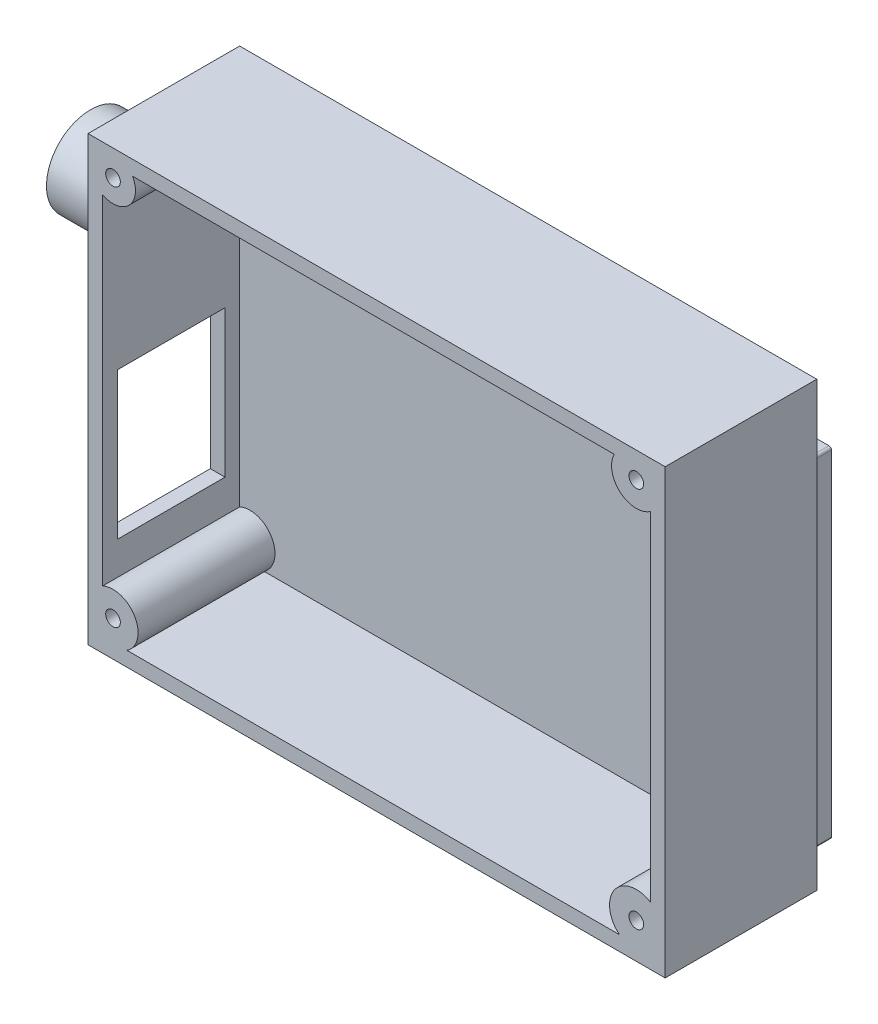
SolidWorks part; units mm, degrees
ref_plane "Plan de face" through (0, 0, 0) normal (0, 0, 1) x (1, 0, 0)
ref_plane "Plan de dessus" through (0, 0, 0) normal (0, 1, 0) x (1, 0, 0)
ref_plane "Plan de droite" through (0, 0, 0) normal (1, 0, 0) x (0, 0, -1)
imported_body "Importée1"
sketch "Esquisse2" plane through (0, 0, 0) normal (0, 0, -1) x (-1, 0, 0)
  circle A0 centre (7, 76.575) radius 2 construction
  circle A1 centre (7, 76.575) radius 2
  circle A2 centre (77.5, 76.575) radius 2 construction
  circle A3 centre (7, 11.075) radius 2 construction
  circle A4 centre (77.5, 11.075) radius 2 construction
  circle A5 centre (77.5, 76.575) radius 2
  circle A6 centre (7, 11.075) radius 2
  circle A7 centre (77.5, 11.075) radius 2
extrude "Boss.-Extru.1" add sketch "Esquisse2" against normal up to surface (7 mm away)
sketch "Esquisse4" plane through (0, 0, 0) normal (0, 0, -1) x (-1, 0, 0)
  line L0 (83, 74.575) -> (1, 74.575) construction
  line L1 (1, 82.575) -> (83.5, 82.575)
  line L2 (1, 82.575) -> (1, 74.575)
  line L3 (1, 74.575) -> (83.5, 74.575)
  line L4 (83.5, 82.575) -> (83.5, 74.575)
  line L5 (1, 7.075) -> (1, 80.575) construction
  dimension "D1" = 8
  dimension "D2" = 82.5
extrude "Enlèv. mat.-Extru.1" cut sketch "Esquisse4" against normal up to surface (4 mm away)
sketch "Esquisse5" plane through (0, 0, 0) normal (0, 0, -1) x (-1, 0, 0)
  line L0 (83.5, 5.075) -> (83.5, 7.075)
  line L2 (83.5, 5.075) -> (81.5, 5.075)
  line L3 (1, 7.075) -> (1, 5.075)
  line L4 (1, 5.075) -> (3, 5.075)
  arc A0 (81.5, 5.075) -> (83.5, 7.075) centre (81.5, 7.075) ccw construction
  arc A1 (81.5, 5.075) -> (83.5, 7.075) centre (81.5, 7.075) ccw
  arc A2 (1, 7.075) -> (3, 5.075) centre (3, 7.075) ccw construction
  arc A3 (1, 7.075) -> (3, 5.075) centre (3, 7.075) ccw
extrude "Boss.-Extru.2" add sketch "Esquisse5" against normal up to surface (4 mm away)
sketch "Esquisse6" plane through (0, 0, 0) normal (0, 0, -1) x (-1, 0, 0)
  line L0 (83.5, 74.575) -> (83.5, 5.075) construction
  line L1 (83.5, 74.575) -> (83.5, 5.075)
  line L2 (83, 74.575) -> (83, 5.075)
  line L3 (83.5, 74.575) -> (1, 74.575) construction
  line L4 (83.5, 5.075) -> (1, 5.075) construction
  line L5 (83, 5.075) -> (83.5, 5.075)
  line L6 (83, 74.575) -> (83.5, 74.575)
  dimension "D1" = 0.5
extrude "Enlèv. mat.-Extru.2" cut sketch "Esquisse6" against normal up to surface (4 mm away)
fillet "Congé1" radius 0.5 4 edges at (-1, 74.575, 2) (-1, 5.075, 2) (-83, 74.575, 2) (-83, 5.075, 2)
